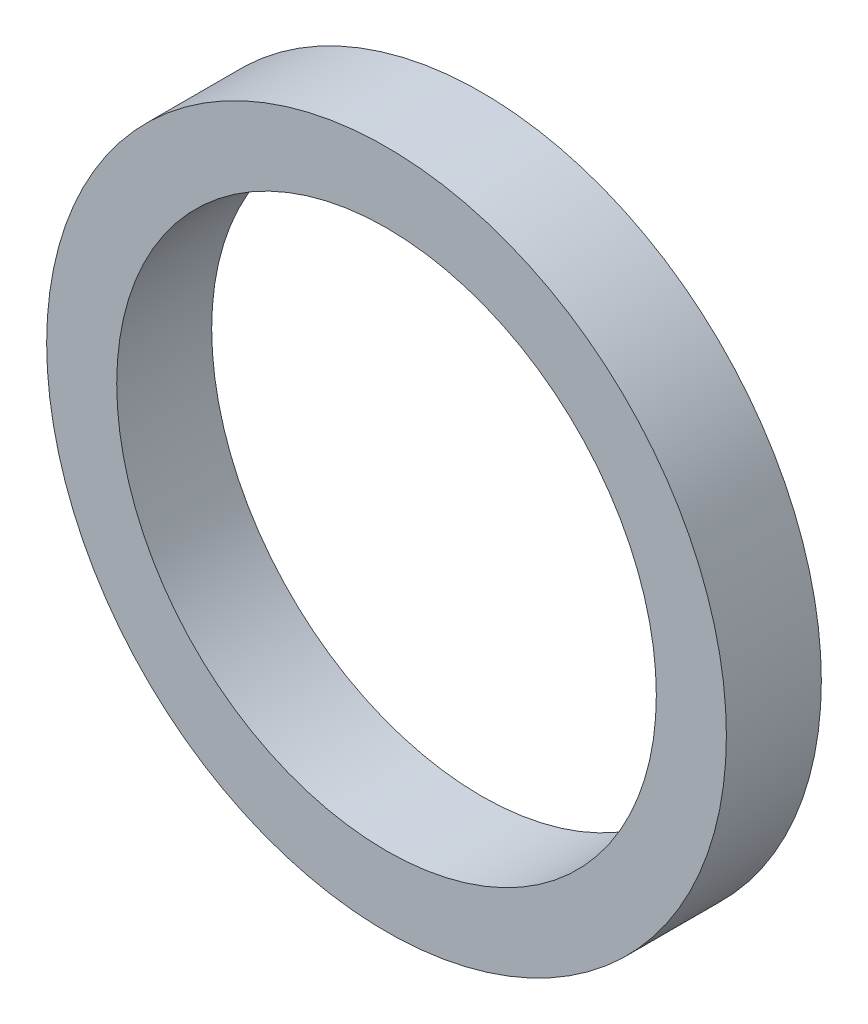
SolidWorks part; units mm, degrees
ref_plane "Plan de face" through (0, 0, 0) normal (0, 0, 1) x (1, 0, 0)
ref_plane "Plan de dessus" through (0, 0, 0) normal (0, 1, 0) x (1, 0, 0)
ref_plane "Plan de droite" through (0, 0, 0) normal (1, 0, 0) x (0, 0, -1)
sketch "Esquisse1" plane through (0, 0, 0) normal (1, 0, 0) x (0, 0, -1)
  line L0 (0, 0) -> (8.7357, 0) construction
  line L2 (0, 11.65) -> (4.1, 11.65)
  line L3 (0, 11.65) -> (0, 14.675)
  line L4 (0, 14.675) -> (4.1, 14.675)
  line L5 (4.1, 11.65) -> (4.1, 14.675)
  dimension "D1" = 4.1
  dimension "D2" = 29.35
  dimension "D3" = 23.3
revolve "Révolution1" add sketch "Esquisse1" angle 360 about L0
